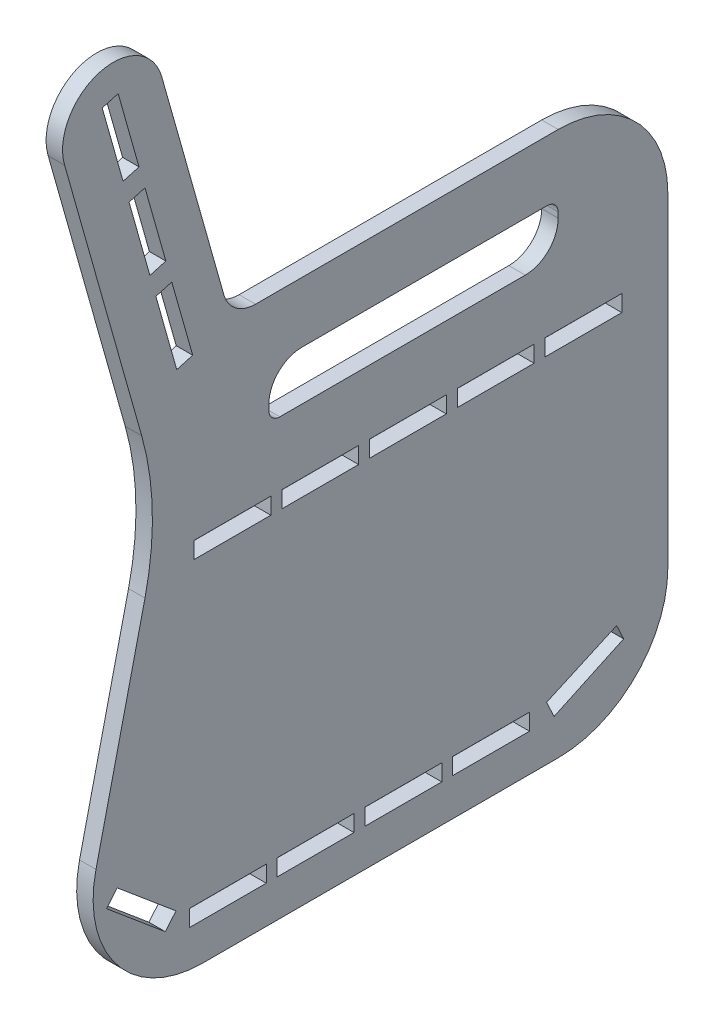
SolidWorks part; units mm, degrees
ref_plane "Front Plane" through (0, 0, 0) normal (0, 0, 1) x (1, 0, 0)
ref_plane "Top Plane" through (0, 0, 0) normal (0, 1, 0) x (1, 0, 0)
ref_plane "Right Plane" through (0, 0, 0) normal (1, 0, 0) x (0, 0, -1)
sketch "Sketch1" plane through (0, 0, 0) normal (1, 0, 0) x (0, 0, -1)
  line L1 (40.0783, -37.1556) -> (364.112, -37.1556)
  line L2 (130.3214, 403.9579) -> (354.112, 403.9579)
  line L3 (100.3214, 373.9579) -> (100.3214, 369.0858)
  line L4 (-85.888, 655.8103) -> (-15.6337, 407.0721)
  line L5 (-12.622, 277.4262) -> (-57.3152, 85.5273)
  line L6 (464.112, 62.8444) -> (464.112, 359.0858)
  line L7 (110.3214, 359.0858) -> (334.112, 359.0858)
  line L8 (364.112, 459.0858) -> (88.1655, 459.0858)
  line L9 (59.2949, 480.9315) -> (2.5204, 681.9443)
  line L10 (364.112, 393.9579) -> (364.112, 389.0858)
  arc A0 (2.5204, 681.9443) -> (-85.888, 655.8103) centre (-41.6838, 668.8773) ccw
  arc A1 (130.3214, 403.9579) -> (100.3214, 373.9579) centre (130.3214, 373.9579) ccw
  arc A2 (334.112, 359.0858) -> (364.112, 389.0858) centre (334.112, 389.0858) ccw
  arc A3 (-15.6337, 407.0721) -> (-12.622, 277.4262) centre (-265.845, 336.4018) cw
  arc A4 (40.0783, -37.1556) -> (-57.3152, 85.5273) centre (40.0783, 62.8444) cw
  arc A5 (464.112, 62.8444) -> (364.112, -37.1556) centre (364.112, 62.8444) cw
  arc A6 (464.112, 359.0858) -> (364.112, 459.0858) centre (364.112, 359.0858) ccw
  arc A7 (354.112, 403.9579) -> (364.112, 393.9579) centre (354.112, 393.9579) cw
  arc A8 (100.3214, 369.0858) -> (110.3214, 359.0858) centre (110.3214, 369.0858) ccw
  arc A9 (88.1655, 459.0858) -> (59.2949, 480.9315) centre (88.1655, 489.0858) cw
  point P15 (-85.888, -37.1556)
  point P19 (464.112, -37.1556)
  dimension "D1" = 550
  dimension "D2" = 30
  dimension "D3" = 30
  dimension "D4" = 260
  dimension "D5" = 100
  dimension "D6" = 100
  dimension "D7" = 100
  dimension "D8" = 10
  dimension "D9" = 10
  dimension "D10" = 30
other "AlignGroup1"
extrude "right_chair" add sketch "Sketch1" along normal mid plane 15
sketch "Sketch2" plane through (0, 0, 0) normal (1, 0, 0) x (0, 0, -1)
  line L0 (-85.888, 655.8103) -> (-15.6337, 407.0721) construction
  line L1 (-32.6004, 616.5543) -> (-51.6271, 683.9189)
  line L2 (-32.6004, 616.5543) -> (-18.0689, 620.6587)
  line L3 (-18.0689, 620.6587) -> (-37.0956, 688.0232)
  line L4 (-51.6271, 683.9189) -> (-37.0956, 688.0232)
  dimension "D1" = 15.1
  dimension "D2" = 70
extrude "respaldo_cut" cut sketch "Sketch2" against normal mid plane 15
pattern_linear "respaldo_pattern" count 3 spacing 90 along (0, -0.9624, -0.2718) of "respaldo_cut"
sketch "Sketch3" plane through (0, 0, 0) normal (1, 0, 0) x (0, 0, -1)
  line L1 (32.1484, 300.5611) -> (102.1484, 300.5611)
  line L2 (32.1484, 300.5611) -> (32.1484, 285.4611)
  line L3 (32.1484, 285.4611) -> (102.1484, 285.4611)
  line L4 (102.1484, 300.5611) -> (102.1484, 285.4611)
  dimension "D1" = 15.1
  dimension "D2" = 70
extrude "sit_cut" cut sketch "Sketch3" against normal mid plane 15
pattern_linear "sit_pattern" count 5 spacing 80 along (0, 0, -1) of "sit_cut"
sketch "Sketch4" plane through (0, 0, 0) normal (1, 0, 0) x (0, 0, -1)
  line L1 (27.9705, 12.0573) -> (97.9705, 12.0573)
  line L2 (27.9705, 12.0573) -> (27.9705, -3.0427)
  line L3 (27.9705, -3.0427) -> (97.9705, -3.0427)
  line L4 (97.9705, 12.0573) -> (97.9705, -3.0427)
  dimension "D1" = 15.1
  dimension "D2" = 70
extrude "base_cut" cut sketch "Sketch4" against normal mid plane 15
pattern_linear "base_pattern" count 4 spacing 80 along (0, 0, -1) of "base_cut"
sketch "Sketch5" plane through (0, 0, 0) normal (1, 0, 0) x (0, 0, -1)
  line L1 (-37.9817, 61.2689) -> (15.6414, 16.2737)
  line L2 (-37.9817, 61.2689) -> (-47.6878, 49.7016)
  line L3 (-47.6878, 49.7016) -> (5.9353, 4.7065)
  line L4 (15.6414, 16.2737) -> (5.9353, 4.7065)
  dimension "D1" = 15.1
  dimension "D2" = 70
extrude "base_cut2" cut sketch "Sketch5" against normal mid plane 15
sketch "Sketch6" plane through (0, 0, 0) normal (1, 0, 0) x (0, 0, -1)
  line L1 (353.5583, 11.9974) -> (417.416, 40.6713)
  line L2 (353.5583, 11.9974) -> (360.3625, -2.5942)
  line L3 (360.3625, -2.5942) -> (423.804, 26.9891)
  line L4 (417.416, 40.6713) -> (423.804, 26.9891)
  dimension "D1" = 15.1
  dimension "D2" = 70
extrude "base_cut3" cut sketch "Sketch6" against normal mid plane 15
